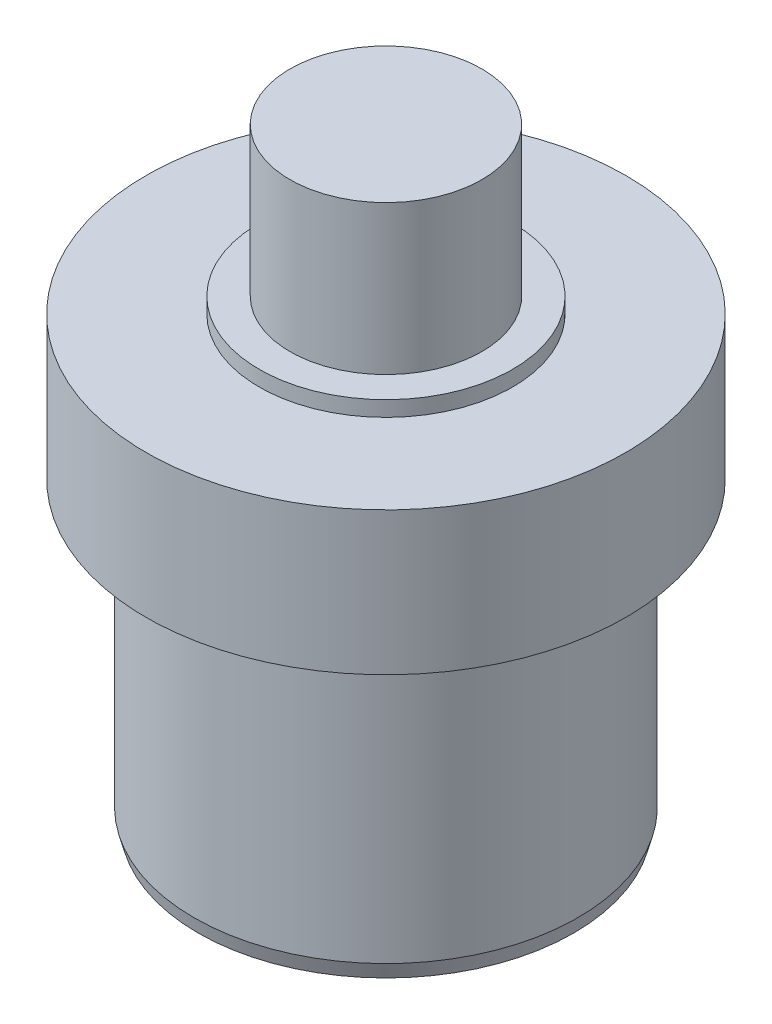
SolidWorks part; units mm, degrees
ref_plane "Front Plane" through (0, 0, 0) normal (0, 0, 1) x (1, 0, 0)
ref_plane "Top Plane" through (0, 0, 0) normal (0, 1, 0) x (1, 0, 0)
ref_plane "Right Plane" through (0, 0, 0) normal (1, 0, 0) x (0, 0, -1)
sketch "Sketch2" plane through (0, 0, 0) normal (0, 1, 0) x (1, 0, 0)
  circle A0 centre (0, 0) radius 3.9688
extrude "Extrude1" add sketch "Sketch2" along normal blind 2.3622
sketch "Sketch3" plane through (0, 0, 0) normal (0, -1, 0) x (1, 0, 0)
  circle A0 centre (0, 0) radius 3.175
extrude "Extrude2" add sketch "Sketch3" along normal blind 4.953
sketch "Sketch4" plane through (0, 2.3622, 0) normal (0, 1, 0) x (-1, 0, 0)
  circle A0 centre (0, 0) radius 2.0955
extrude "Extrude3" add sketch "Sketch4" along normal blind 0.254
sketch "Sketch5" plane through (0, 2.6162, 0) normal (0, 1, 0) x (-1, 0, 0)
  circle A0 centre (0, 0) radius 1.5875
extrude "Extrude4" add sketch "Sketch5" along normal blind 2.4638
chamfer "Chamfer1" distance 0.254 angle 15 1 edges at (0, -4.953, -3.175)
